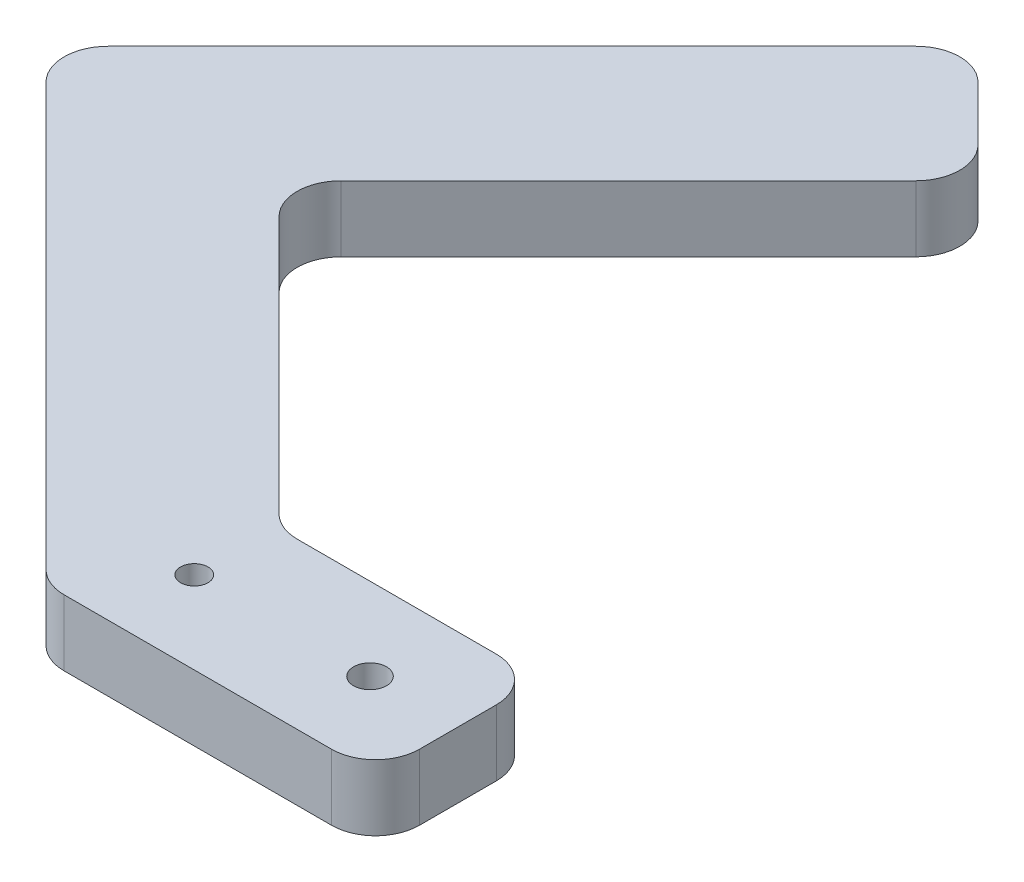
SolidWorks part; units mm, degrees
ref_plane "Ön Düzlem" through (0, 0, 0) normal (0, 0, 1) x (1, 0, 0)
ref_plane "Üst Düzlem" through (0, 0, 0) normal (0, 1, 0) x (1, 0, 0)
ref_plane "Sağ Düzlem" through (0, 0, 0) normal (1, 0, 0) x (0, 0, -1)
sketch "Çizim1" plane through (0, 0, 0) normal (0, 1, 0) x (1, 0, 0)
  line L0 (0, 0) -> (0, 15)
  line L1 (0, 15) -> (-23.7868, 15)
  line L2 (-23.7868, 15) -> (-51.2132, 42.4264)
  line L3 (-51.2132, 42.4264) -> (-19.3934, 74.2462)
  line L4 (-19.3934, 74.2462) -> (-30, 84.8528)
  line L5 (-30, 84.8528) -> (-72.4264, 42.4264)
  line L6 (-72.4264, 42.4264) -> (-30, 0)
  line L7 (-30, 0) -> (0, 0)
  circle A0 centre (-8, 7.5) radius 1.5
  circle A1 centre (-24, 7.5) radius 1.25
  dimension "D8" = 3
  dimension "D9" = 2.5
  dimension "D10" = 8
  dimension "D11" = 24
  dimension "D12" = 7.5
  dimension "D13" = 7.5
  dimension "D1" = 15
  dimension "D2" = 15
  dimension "D3" = 15
  dimension "D4" = 135
  dimension "D5" = 30
  dimension "D6" = 60
  dimension "D7" = 60
extrude "Yükseklik-Ekstrüzyon1" add sketch "Çizim1" along normal blind 6
fillet "Radyus1" radius 4 8 edges at (-51.2132, 3, -42.4264) (-23.7868, 3, -15) (0, 3, -15) (0, 3, 0) (-30, 3, 0) (-72.4264, 3, -42.4264) (-19.3934, 3, -74.2462) (-30, 3, -84.8528)
